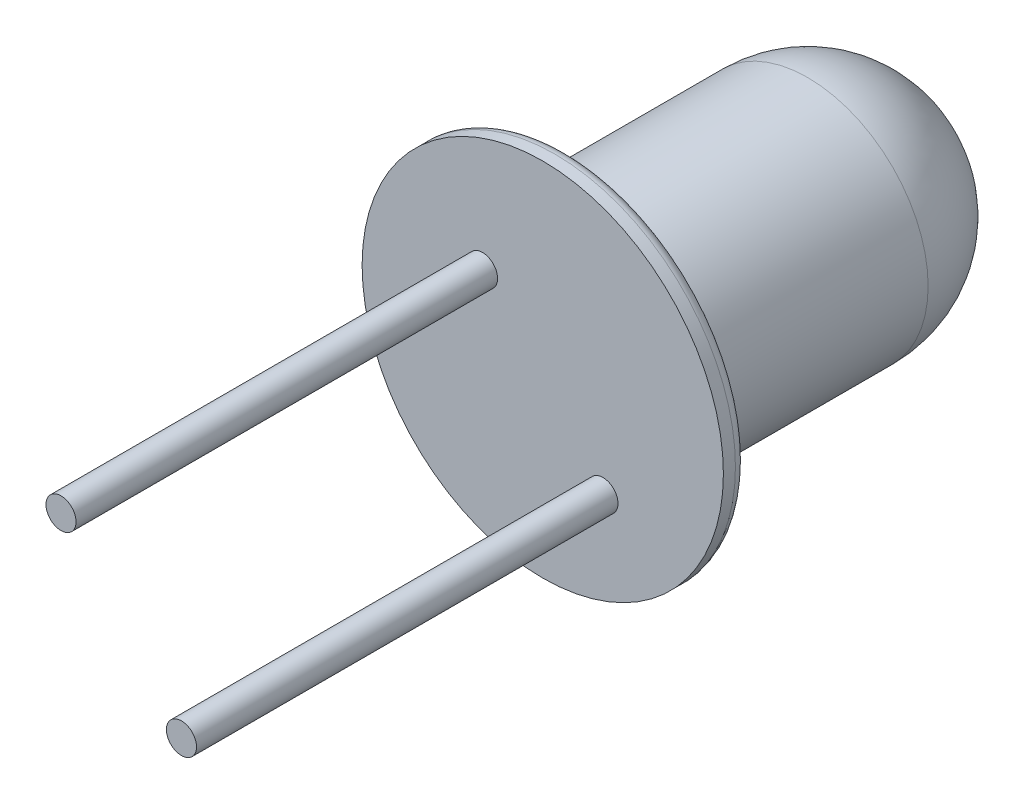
SolidWorks part; units mm, degrees
ref_plane "Front Plane" through (0, 0, 0) normal (0, 0, 1) x (1, 0, 0)
ref_plane "Top Plane" through (0, 0, 0) normal (0, 1, 0) x (1, 0, 0)
ref_plane "Right Plane" through (0, 0, 0) normal (1, 0, 0) x (0, 0, -1)
sketch "Skizze4" plane through (0, 0, 0) normal (0, 0, 1) x (1, 0, 0)
  circle A0 centre (12.2185, 5.6724) radius 1
  circle A1 centre (12.2185, 5.6724) radius 1 construction
extrude "Linear austragen1" add sketch "Skizze4" against normal up to surface (3 mm away)
fillet "Verrundung3" radius 1 1 edges at (11.2185, 5.6724, -3)
sketch "Skizze5" plane through (0, 0, 0) normal (0, 0, 1) x (1, 0, 0)
  circle A0 centre (12.2185, 5.6724) radius 1.5
  circle A1 centre (12.2185, 5.6724) radius 1 construction
  dimension "D1" = 3
extrude "Linear austragen2" add sketch "Skizze5" along normal blind 0.2
fillet "Verrundung6" radius 0.1 1 edges at (13.7185, 5.6724, 0)
fillet "Verrundung7" radius 0.1 1 edges at (13.2185, 5.6724, 0)
sketch "Skizze6" plane through (0, 0, 0.2) normal (0, 0, 1) x (1, 0, 0)
  circle A0 centre (11.7185, 6.1392) radius 0.125
  circle A1 centre (12.7185, 5.0211) radius 0.125
  circle A2 centre (12.2185, 5.6724) radius 1.5 construction
  dimension "D1" = 0.25
  dimension "D2" = 0.25
  dimension "D3" = 0.5
  dimension "D4" = 0.5
  dimension "D5" = 1.5
extrude "Linear austragen3" add sketch "Skizze6" along normal blind 3.5
